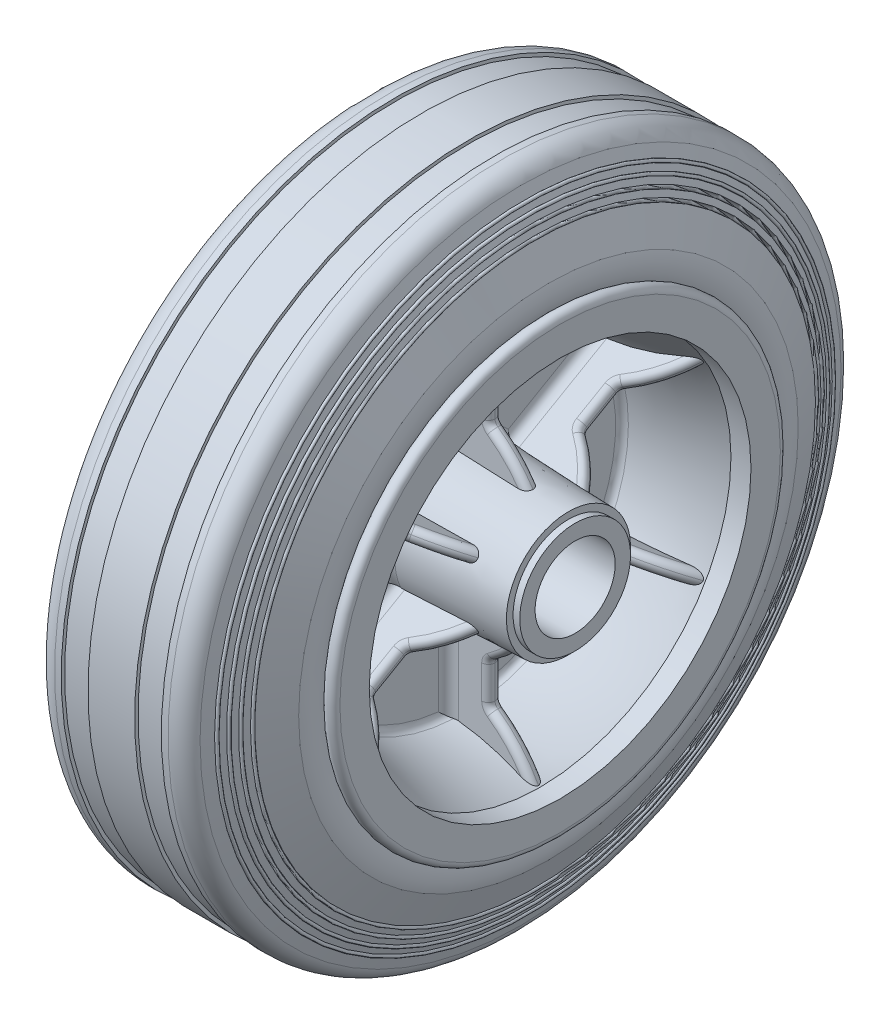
SolidWorks part; units mm, degrees
ref_plane "Anteriore" through (0, 0, 0) normal (0, 0, 1) x (1, 0, 0)
ref_plane "Superiore" through (0, 0, 0) normal (0, 1, 0) x (1, 0, 0)
ref_plane "Destro" through (0, 0, 0) normal (1, 0, 0) x (0, 0, -1)
sketch "Schizzo1" plane through (0, 0, 0) normal (0, 0, 1) x (1, 0, 0)
  line L0 (0, 28.5) -> (0, -5.1192) construction
  line L1 (17.25, 33) -> (17.25, 28.6)
  line L2 (17.25, 28.6) -> (14.25, 28.6)
  line L3 (1.5, 24.064) -> (1.5, 10.9597)
  line L4 (2.4589, 9.9605) -> (18.5, 9.3)
  line L5 (18.5, 9.3) -> (18.5, 8.3)
  line L6 (18.5, 8.3) -> (19.5, 8.3)
  line L7 (19.5, 8.3) -> (19.5, 6)
  line L8 (19.5, 6) -> (-19.5, 6)
  line L9 (-15.25, 33) -> (-15.25, 30.6)
  line L10 (24.2642, 0) -> (-30.4599, 0) construction
  line L11 (-19.5, 8.3) -> (-19.5, 6)
  line L12 (-18.5, 8.3) -> (-19.5, 8.3)
  line L13 (-18.5, 9.3) -> (-18.5, 8.3)
  line L14 (-2.4589, 9.9605) -> (-18.5, 9.3)
  line L15 (-1.5, 24.064) -> (-1.5, 10.9597)
  line L16 (-17.25, 28.6) -> (-14.25, 28.6)
  line L17 (-17.25, 33) -> (-17.25, 28.6)
  line L18 (15.25, 30.6) -> (13.7299, 30.6)
  line L19 (15.25, 33) -> (15.25, 30.6)
  line L20 (-15.25, 30.6) -> (-13.7299, 30.6)
  arc A0 (14.25, 28.6) -> (2.4186, 25.0607) centre (0, 54.6906) cw
  arc A1 (-14.25, 28.6) -> (-2.4186, 25.0607) centre (0, 54.6906) ccw
  arc A2 (13.7299, 30.6) -> (0, 26.9621) centre (0, 54.6906) cw
  arc A3 (-13.7299, 30.6) -> (0, 26.9621) centre (0, 54.6906) ccw
  arc A4 (17.25, 33) -> (15.25, 33) centre (16.25, 33) ccw
  arc A5 (-17.25, 33) -> (-15.25, 33) centre (-16.25, 33) cw
  arc A6 (1.5, 24.064) -> (2.4186, 25.0607) centre (2.5, 24.064) cw
  arc A7 (1.5, 10.9597) -> (2.4589, 9.9605) centre (2.5, 10.9597) ccw
  arc A8 (-2.4589, 9.9605) -> (-1.5, 10.9597) centre (-2.5, 10.9597) ccw
  arc A9 (-2.4186, 25.0607) -> (-1.5, 24.064) centre (-2.5, 24.064) cw
  point P34 (1.5, 25)
  point P39 (1.5, 10)
  point P44 (-1.5, 25)
  dimension "D12" = 4
  dimension "D14" = 5.4
  dimension "D4" = 34
  dimension "D15" = 1
  dimension "D2" = 12
  dimension "D3" = 34.5
  dimension "D5" = 2.3
  dimension "D6" = 1
  dimension "D7" = 3.3
  dimension "D8" = 3
  dimension "D9" = 15
  dimension "D10" = 18
  dimension "D11" = 39
  dimension "D13" = 2
revolve "Base-Rivoluzione" add sketch "Schizzo1" angle 360 about L10
sketch "Schizzo3" plane through (0, 0, 0) normal (0, 0, 1) x (1, 0, 0)
  line L0 (1.5, -84.3812) -> (1.5, 84.3812) construction
  line L1 (-13.7299, 30.6) -> (-15.25, 30.6) construction
  line L2 (1.5, 6) -> (1.5, 27.0027)
  line L3 (0, -7.145) -> (0, -30.6214) construction
  line L4 (7.5, 21.3) -> (7.5, 15.3)
  line L5 (7.5, 18.3) -> (-12.2574, 18.3) construction
  line L6 (19.5, 6) -> (-19.5, 6) construction
  line L7 (15, 6) -> (1.5, 6)
  line L8 (-15, 6) -> (-1.5, 6)
  line L9 (-7.5, 21.3) -> (-7.5, 15.3)
  line L10 (-1.5, 6) -> (-1.5, 27.0027)
  line L12 (-13.7299, 30.6) -> (-15, 30.6)
  line L13 (15.25, 30.6) -> (13.7299, 30.6) construction
  line L14 (15, 30.6) -> (13.7299, 30.6)
  arc A0 (-1.5, 27.0027) -> (-13.7299, 30.6) centre (0, 54.6906) cw
  arc A1 (-7.5, 15.3) -> (-15, 6) centre (3.6076, -1.3319) ccw
  arc A2 (7.5, 21.3) -> (15, 30.6) centre (-3.6076, 37.9319) ccw
  arc A3 (7.5, 15.3) -> (15, 6) centre (-3.6076, -1.3319) cw
  arc A4 (-13.7299, 30.6) -> (13.7299, 30.6) centre (0, 54.6906) ccw construction
  arc A5 (1.5, 27.0027) -> (13.7299, 30.6) centre (0, 54.6906) ccw
  arc A6 (-7.5, 21.3) -> (-15, 30.6) centre (3.6076, 37.9319) cw
  dimension "D3" = 20
  dimension "D2" = 13.5
  dimension "D1" = 6
  dimension "D4" = 6
extrude "Aggetto-Estrusione5" add sketch "Schizzo3" along normal mid plane 2
fillet "Raccordo1" radius 1 24 edges at (7.5, 21.3, 0) (11.1884, 24.4754, -1) (11.1884, 24.4754, 1) (10.6654, 12.6781, 1) (7.5, 18.3, 1) (10.6654, 12.6781, -1) (7.5, 18.3, -1) (7.5, 15.3, 0) (-11.1884, 24.4754, -1) (13.6204, 81.1092, 1) (-11.1884, 24.4754, 1) (-7.5, 18.3, 1) (-10.6654, 12.6781, 1) (13.6204, 81.1092, -1) (-7.5, 18.3, -1) (-7.5, 21.3, 0) (-7.5, 15.3, 0) (-10.6654, 12.6781, -1)
fillet "Raccordo4" radius 1.5 16 edges at (1.5, 17.4786, -1) (1.801, 24.7589, 1) (1.5, 17.4786, 1) (3.3307, 11.4728, 1) (1.801, 24.7589, -1) (3.3307, 11.4728, -1) (-1.5, 17.4786, -1) (-3.3307, 11.4728, 1) (-1.801, 24.7589, 1) (-1.5, 17.4786, 1) (-3.3307, 11.4728, -1) (-1.801, 24.7589, -1)
pattern_circular "RipetizioneCircolare1" count 6 over 360 about axis through (0, 0, 0) along (1, 0, 0) of "Raccordo1", "Raccordo4", "Aggetto-Estrusione5"
sketch "Schizzo4" plane through (0, 0, 0) normal (0, 0, 1) x (1, 0, 0)
  line L0 (22.6681, 0) -> (-27.1223, 0) construction
  line L1 (15.5, 37.4261) -> (13.5, 42.0087)
  line L2 (13.3296, 42.4788) -> (13.023, 43.3249)
  line L3 (8.5, 50) -> (7.5, 50)
  line L4 (0, 26.409) -> (0, 54.8504) construction
  line L5 (0, -26.4793) -> (0, -28.2113) construction
  line L6 (-11.8985, 46.4274) -> (-11.3205, 48.0222)
  line L7 (-15.5, 37.4261) -> (-13.5, 42.0087)
  line L8 (15.25, 30.6) -> (15.25, 33)
  line L9 (-13.7299, 30.6) -> (-15.25, 30.6)
  line L10 (-15.25, 33) -> (-15.25, 30.6)
  line L12 (-3.5, 50) -> (-3.5, 49.5)
  line L15 (12.8526, 43.795) -> (12.5459, 44.6411)
  line L16 (12.3755, 45.1112) -> (12.0689, 45.9573)
  line L17 (11.8985, 46.4274) -> (11.3205, 48.0222)
  line L18 (-12.3755, 45.1112) -> (-12.0689, 45.9573)
  line L19 (-12.8526, 43.795) -> (-12.5459, 44.6411)
  line L20 (-13.3296, 42.4788) -> (-13.023, 43.3249)
  line L26 (7.5, 50) -> (7.5, 49.5)
  line L27 (7.5, 49.5) -> (3.5, 49.5)
  line L28 (3.5, 50) -> (3.5, 49.5)
  line L29 (-7.5, 49.5) -> (-3.5, 49.5)
  line L30 (-7.5, 50) -> (-7.5, 49.5)
  line L32 (3.5, 50) -> (-3.5, 50)
  line L33 (-7.5, 50) -> (-8.5, 50)
  line L34 (15.25, 30.6) -> (13.7299, 30.6)
  arc A0 (15.5, 37.4261) -> (15.3243, 33.3782) centre (9.7698, 35.6471) cw
  arc A1 (17.25, 33) -> (15.25, 33) centre (16.25, 33) ccw construction
  arc A2 (-15.25, 33) -> (-17.25, 33) centre (-16.25, 33) ccw construction
  arc A3 (-15.25, 33) -> (-15.3243, 33.3782) centre (-16.25, 33) ccw
  arc A4 (15.3243, 33.3782) -> (15.25, 33) centre (16.25, 33) ccw
  arc A5 (13.7299, 30.6) -> (-13.7299, 30.6) centre (0, 54.6906) cw
  arc A6 (11.3205, 48.0222) -> (8.5, 50) centre (8.5, 47) ccw
  arc A7 (-11.3205, 48.0222) -> (-8.5, 50) centre (-8.5, 47) cw
  arc A8 (13.5, 42.0087) -> (13.3296, 42.4788) centre (13.4148, 42.2437) ccw
  arc A9 (13.023, 43.3249) -> (12.8526, 43.795) centre (12.9378, 43.5599) ccw
  arc A10 (12.5459, 44.6411) -> (12.3755, 45.1112) centre (12.4607, 44.8762) ccw
  arc A11 (12.0689, 45.9573) -> (11.8985, 46.4274) centre (11.9837, 46.1924) ccw
  arc A12 (-12.0689, 45.9573) -> (-11.8985, 46.4274) centre (-11.9837, 46.1924) cw
  arc A13 (-12.5459, 44.6411) -> (-12.3755, 45.1112) centre (-12.4607, 44.8762) cw
  arc A14 (-13.023, 43.3249) -> (-12.8526, 43.795) centre (-12.9378, 43.5599) cw
  arc A15 (-13.5, 42.0087) -> (-13.3296, 42.4788) centre (-13.4148, 42.2437) cw
  arc A16 (-1.5, 27.0027) -> (1.5, 27.0027) centre (0, 54.6906) ccw construction
  arc A17 (-15.5, 37.4261) -> (-15.3243, 33.3782) centre (-9.7698, 35.6471) ccw
  point P30 (10.6037, 50)
  dimension "D1" = 8.5
  dimension "D7" = 6
  dimension "D8" = 23
  dimension "D9" = 3
  dimension "D11" = 1.4
  dimension "D13" = 0.5
  dimension "D2" = 5
  dimension "D3" = 4
  dimension "D4" = 50
  dimension "D5" = 27
  dimension "D6" = 31
  dimension "D14" = 7
  dimension "D15" = 0.5
revolve "Aggetto-Rivoluzione10" add sketch "Schizzo4" angle 360 about L0
scale "Scale1" scale about centroid uniform scaling yes scale factor 1.3
